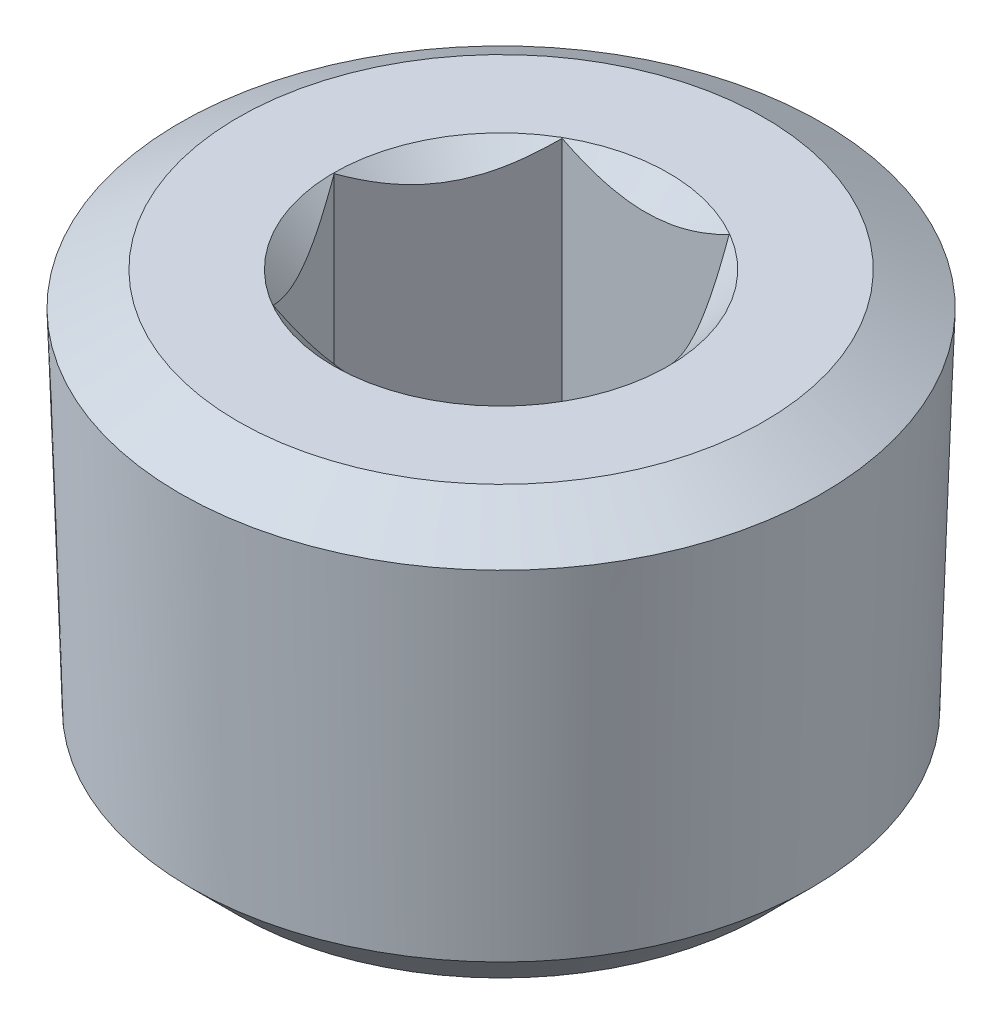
SolidWorks part; units mm, degrees
ref_plane "Front Plane" through (0, 0, 0) normal (0, 0, 1) x (1, 0, 0)
ref_plane "Top Plane" through (0, 0, 0) normal (0, 1, 0) x (1, 0, 0)
ref_plane "Right Plane" through (0, 0, 0) normal (1, 0, 0) x (0, 0, -1)
sketch "Sketch2" plane through (0, 0, 0) normal (0, 0, 1) x (1, 0, 0)
  line L0 (0, 10.7443) -> (0, -17.0657) construction
  line L1 (0, 0) -> (-8.7873, 0)
  line L2 (-10.722, -1.117) -> (-10.3604, -12.7017)
  line L3 (-8.7873, -14.2748) -> (0, -14.2748)
  line L4 (0, -14.2748) -> (0, 0)
  line L6 (-8.7873, -14.2748) -> (-10.3604, -12.7017)
  line L7 (-8.7873, 0) -> (-10.722, -1.117)
  point P4 (-10.7569, 0)
  point P6 (-10.3113, -14.2748)
  dimension "D1" = 14.2748
  dimension "D2" = 1.788
  dimension "D3" = 21.5138
  dimension "D4" = 30
  dimension "D5" = 1.524
  dimension "D6" = 45
revolve "Revolve1" add sketch "Sketch2" angle 360 about L0
sketch "Sketch3" plane through (0, 0, 0) normal (0, 0, 1) x (1, 0, 0)
  line L0 (0, 2.9342) -> (0, -8.1202) construction
  line L1 (0, 0) -> (-5.588, 0)
  line L2 (8.7873, 0) -> (-8.7873, 0) construction
  line L3 (-4.826, -0.762) -> (-4.826, -8.89)
  line L4 (-4.826, -8.89) -> (-2.7124, -10.16)
  line L5 (0, -10.16) -> (0, 0)
  line L6 (-4.826, -0.762) -> (-5.588, 0)
  line L7 (-2.7124, -10.16) -> (0, -10.16)
  dimension "D1" = 8.89
  dimension "D2" = 59
  dimension "D3" = 9.652
  dimension "D4" = 0.762
  dimension "D5" = 45
  dimension "D6" = 10.16
revolve "Cut-Revolve1" cut sketch "Sketch3" angle 360 about L0
sketch "Sketch4" plane through (0, 0, 0) normal (0, 1, 0) x (1, 0, 0)
  line L1 (-2.7863, -4.826) -> (2.7863, -4.826)
  line L2 (2.7863, -4.826) -> (5.5726, 0)
  line L3 (5.5726, 0) -> (2.7863, 4.826)
  line L4 (2.7863, 4.826) -> (-2.7863, 4.826)
  line L5 (-2.7863, 4.826) -> (-5.5726, 0)
  line L6 (-5.5726, 0) -> (-2.7863, -4.826)
  circle A0 centre (0, 0) radius 4.826 construction
  circle A1 centre (0, 0) radius 4.826 construction
extrude "Cut-Extrude1" cut sketch "Sketch4" against normal up to vertex (5.2929 mm away)
